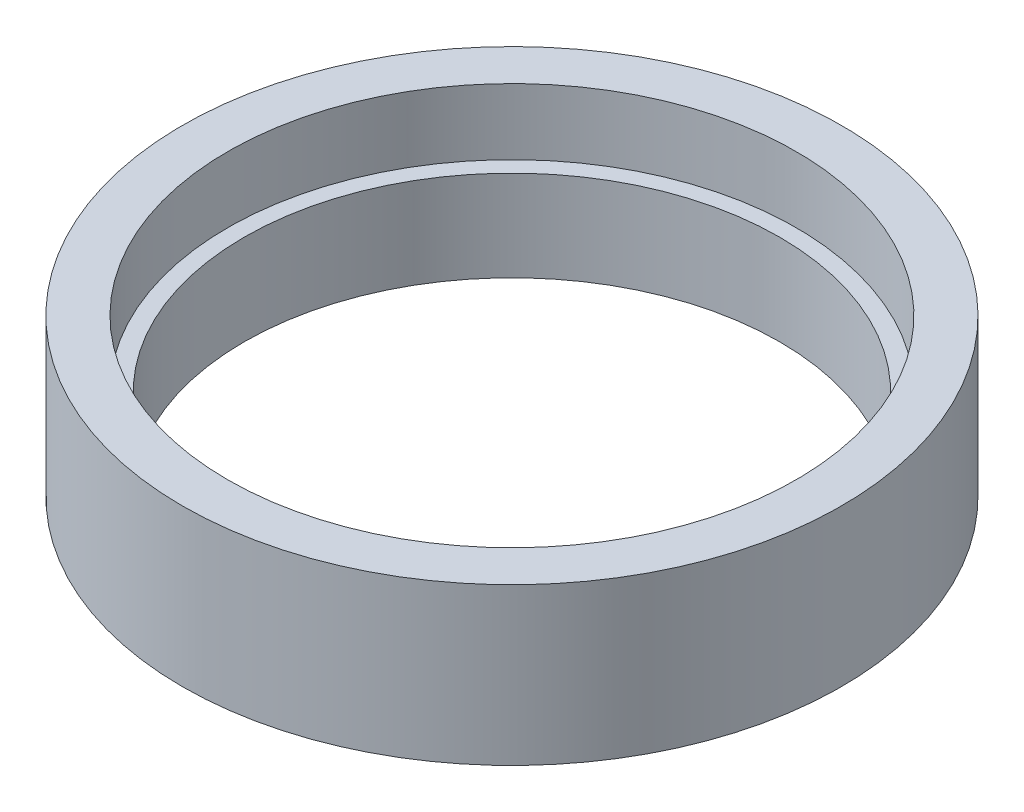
SolidWorks part; units mm, degrees
ref_plane "Alzado" through (0, 0, 0) normal (0, 0, 1) x (1, 0, 0)
ref_plane "Planta" through (0, 0, 0) normal (0, 1, 0) x (1, 0, 0)
ref_plane "Vista lateral" through (0, 0, 0) normal (1, 0, 0) x (0, 0, -1)
sketch "Croquis1" plane through (0, 0, 0) normal (0, 1, 0) x (1, 0, 0)
  circle A0 centre (0, 0) radius 40
  dimension "D1" = 80
extrude "Saliente-Extruir1" add sketch "Croquis1" along normal blind 19
sketch "Croquis2" plane through (0, 19, 0) normal (0, 1, 0) x (1, 0, 0)
  circle A0 centre (0, 0) radius 34.5
  dimension "D1" = 69
extrude "Cortar-Extruir1" cut sketch "Croquis2" against normal blind 8
sketch "Croquis3" plane through (0, 11, 0) normal (0, 1, 0) x (1, 0, 0)
  circle A0 centre (0, 0) radius 32.5
  dimension "D1" = 65
extrude "Cortar-Extruir2" cut sketch "Croquis3" against normal blind 48
